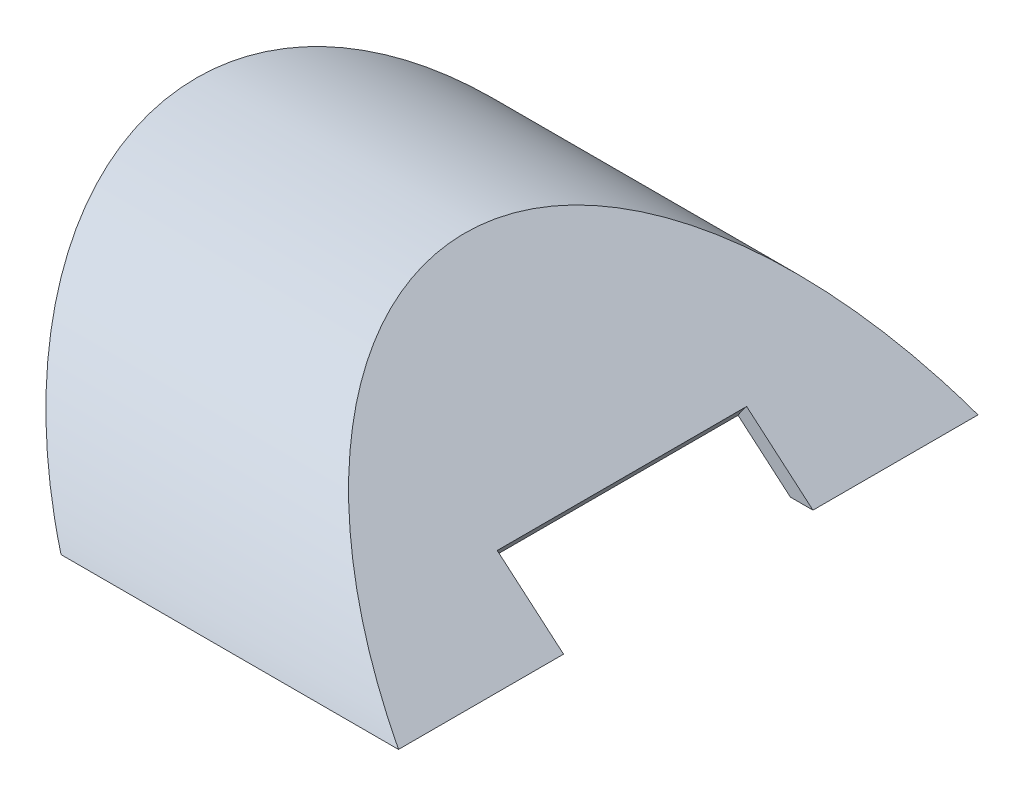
SolidWorks part; units mm, degrees
ref_plane "Plan de face" through (0, 0, 0) normal (0, 0, 1) x (1, 0, 0)
ref_plane "Plan de dessus" through (0, 0, 0) normal (0, 1, 0) x (1, 0, 0)
ref_plane "Plan de droite" through (0, 0, 0) normal (1, 0, 0) x (0, 0, -1)
sketch "Esquisse1" plane through (0, 0, 0) normal (0, 0, 1) x (1, 0, 0)
  line L1 (23, 8.5) -> (7.779, 21.5)
  line L2 (0, 8.5) -> (23, 8.5)
  line L3 (7.779, 21.5) -> (-10.5272, 21.5)
  line L6 (-10.5272, 21.5) -> (0, 8.5)
  dimension "D1" = 8.5
  dimension "D5" = 51
  dimension "D6" = 13
  dimension "D7" = 40.5
  dimension "D8" = 23
extrude "Extrusion1" add sketch "Esquisse1" along normal mid plane 60
sketch "Esquisse2" plane through (0, 0, 0) normal (1, 0, 0) x (0, 0, -1)
  circle A0 centre (0, 0) radius 21.5
  dimension "D1" = 43
extrude "Enlèv. mat.-Extru.1" cut sketch "Esquisse2" against normal mid plane 60 flip side to cut
shell "Coque3" thickness 1
sketch "Esquisse3" plane through (4.9343, 3.9957, 0) normal (0.7771, 0.6293, 0) x (0, 0, -1)
  line L0 (-18.6548, 5.796) -> (18.6548, 5.796) construction
  line L1 (-18.6548, 5.796) -> (18.6548, 5.796)
  ellipse E0 centre (0, -5.1415) end of major axis (0, 21.2371) minor radius 20.5 (18.6548, 5.796) -> (-18.6548, 5.796) ccw construction
  ellipse E1 centre (0, -5.1415) end of major axis (0, -31.5201) minor radius 20.5 (18.6548, 5.796) -> (-18.6548, 5.796) ccw
extrude "Enlèv. mat.-Extru.3" cut sketch "Esquisse3" against normal through all
sketch "Esquisse4" plane through (0, 0, 0) normal (0, 0, 1) x (1, 0, 0)
  circle A0 centre (23, 8.5) radius 5.9451
extrude "Enlèv. mat.-Extru.4" cut sketch "Esquisse4" against normal mid plane 17
